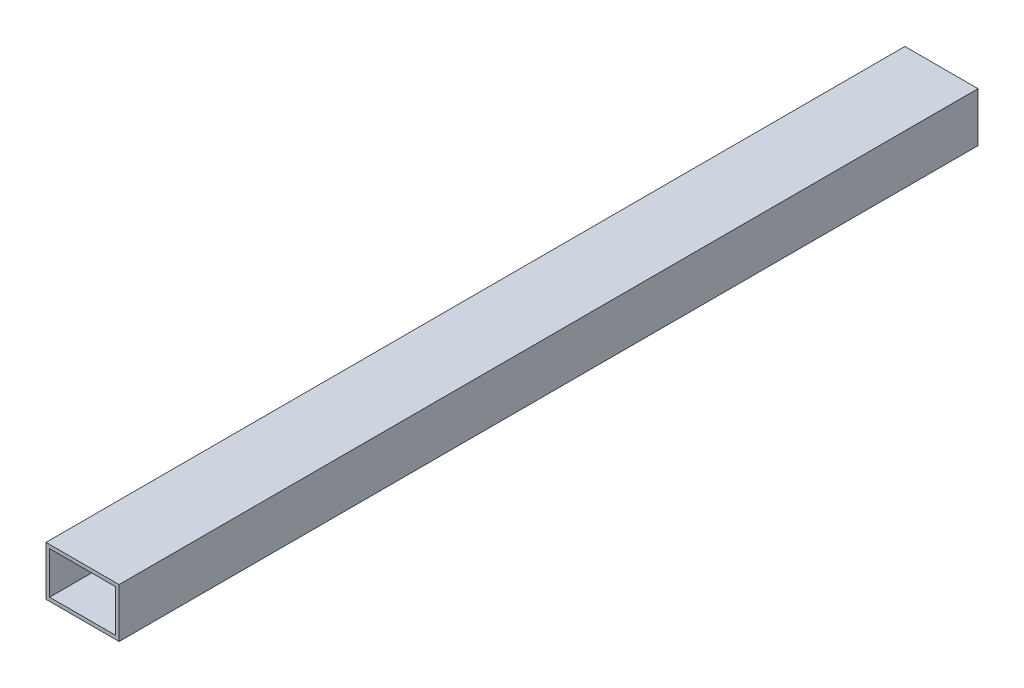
SolidWorks part; units mm, degrees
ref_plane "Plan de face" through (0, 0, 0) normal (0, 0, 1) x (1, 0, 0)
ref_plane "Plan de dessus" through (0, 0, 0) normal (0, 1, 0) x (1, 0, 0)
ref_plane "Plan de droite" through (0, 0, 0) normal (1, 0, 0) x (0, 0, -1)
sketch "Esquisse1" plane through (0, 0, 0) normal (0, 0, 1) x (1, 0, 0)
  line L0 (-2, -2) -> (-2, 25)
  line L1 (0, 0) -> (36, 0)
  line L2 (0, 0) -> (0, 23)
  line L3 (0, 23) -> (36, 23)
  line L4 (36, 0) -> (36, 23)
  line L5 (-2, 25) -> (38, 25)
  line L6 (38, -2) -> (38, 25)
  line L7 (-2, -2) -> (38, -2)
  dimension "D2" = 40
  dimension "D3" = 27
  dimension "D1" = 2
extrude "Extrusion1" add sketch "Esquisse1" along normal blind 470
